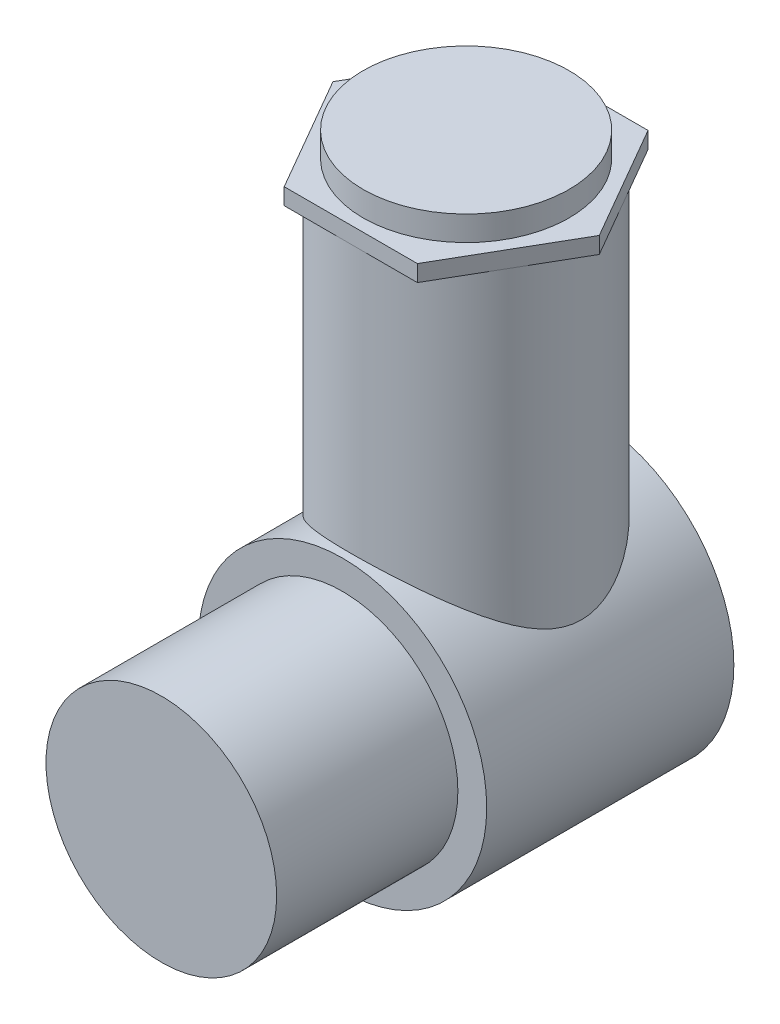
SolidWorks part; units mm, degrees
ref_plane "Front Plane" through (0, 0, 0) normal (0, 0, 1) x (1, 0, 0)
ref_plane "Top Plane" through (0, 0, 0) normal (0, 1, 0) x (1, 0, 0)
ref_plane "Right Plane" through (0, 0, 0) normal (1, 0, 0) x (0, 0, -1)
sketch "Sketch1" plane through (0, 0, 0) normal (0, 0, 1) x (1, 0, 0)
  circle A0 centre (0, 0) radius 175
extrude "Boss-Extrude1" add sketch "Sketch1" along normal mid plane 300
sketch "Sketch2" plane through (0, 0, 150) normal (0, 0, 1) x (1, 0, 0)
  circle A0 centre (0, 0) radius 140
extrude "Boss-Extrude2" add sketch "Sketch2" along normal blind 220
sketch "Sketch3" plane through (0, 0, 0) normal (0, 1, 0) x (1, 0, 0)
  circle A0 centre (0, 0) radius 140
extrude "Boss-Extrude3" add sketch "Sketch3" along normal blind 500
sketch "Sketch4" plane through (0, 500, 0) normal (0, 1, 0) x (1, 0, 0)
  line L7 (80.829, 140) -> (-80.829, 140)
  line L8 (-80.829, 140) -> (-161.6581, 0)
  line L9 (-161.6581, 0) -> (-80.829, -140)
  line L10 (-80.829, -140) -> (80.829, -140)
  line L11 (80.829, -140) -> (161.6581, 0)
  line L12 (161.6581, 0) -> (80.829, 140)
  circle A0 centre (0, 0) radius 140 construction
extrude "Boss-Extrude4" add sketch "Sketch4" along normal blind 20
sketch "Sketch5" plane through (0, 520, 0) normal (0, 1, 0) x (1, 0, 0)
  circle A0 centre (0, 0) radius 125
  dimension "D1" = 250
extrude "Boss-Extrude5" add sketch "Sketch5" along normal blind 30
equation "\"connector1_l\"= 250"
equation "\"connector1_d\"= 350"
equation "\"connector2_l\"= 220"
equation "\"connector2_d\"= 280"
equation "\"member1_d\"= 350"
equation "\"member2_d\"= 280"
equation "\"end_l\" = 400"
equation "\"end_d\" = 420"
equation "\"p1_m2_l\" = 250"
equation "\"p1_m1_l\" = 200"
equation "\"p2_m_l\" = 7500"
equation "\"p3_m_l\" = 4000"
equation "\"p3_offset\" = 400"
equation "\"end2_l\" = 300"
equation "\"end2_d\" = 350"
equation "\"p4_m_l\" = 3500"
equation "\"D1@Sketch1\"=\"end2_d\""
equation "\"D1@Boss-Extrude1\"=\"end2_l\""
equation "\"D1@Sketch2\"=\"connector2_d\""
equation "\"D1@Boss-Extrude2\"=\"connector2_l\""
equation "\"D1@Sketch3\"=\"member2_d\""
